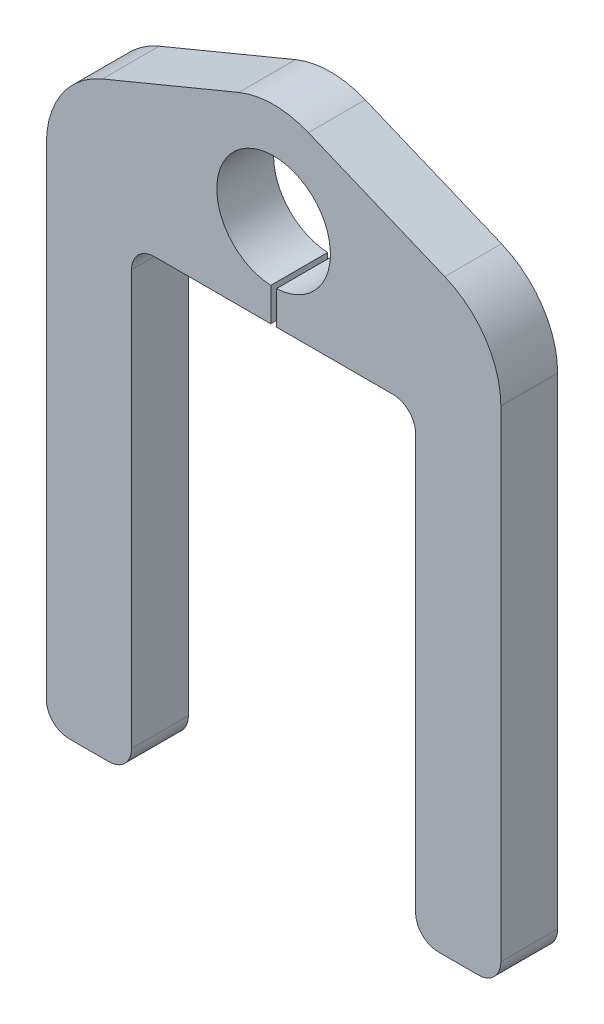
SolidWorks part; units mm, degrees
ref_plane "Front Plane" through (0, 0, 0) normal (0, 0, 1) x (1, 0, 0)
ref_plane "Top Plane" through (0, 0, 0) normal (0, 1, 0) x (1, 0, 0)
ref_plane "Right Plane" through (0, 0, 0) normal (1, 0, 0) x (0, 0, -1)
sketch "Sketch1" plane through (0, 0, 0) normal (0, 0, 1) x (1, 0, 0)
  line L2 (310.9504, 299.8517) -> (310.9504, 318.4745)
  line L3 (307.7754, 299.8517) -> (307.7754, 318.4745)
  line L4 (436.3629, 324.3937) -> (436.3629, 55.3767)
  line L5 (182.3629, 324.3937) -> (182.3629, 55.3767)
  line L6 (401.4379, 42.6767) -> (423.6629, 42.6767)
  line L7 (217.2879, 42.6767) -> (195.0629, 42.6767)
  line L8 (376.0379, 299.8517) -> (310.9504, 299.8517)
  line L9 (307.7754, 299.8517) -> (242.6879, 299.8517)
  line L10 (388.7379, 287.1517) -> (388.7379, 55.3767)
  line L11 (229.9879, 287.1517) -> (229.9879, 55.3767)
  line L12 (405.0176, 371.3208) -> (328.8176, 402.9113)
  line L13 (213.7081, 371.3208) -> (289.9081, 402.9113)
  arc A0 (182.3629, 55.3767) -> (195.0629, 42.6767) centre (195.0629, 55.3767) ccw
  arc A1 (242.6879, 299.8517) -> (229.9879, 287.1517) centre (242.6879, 287.1517) ccw
  arc A2 (388.7379, 287.1517) -> (376.0379, 299.8517) centre (376.0379, 287.1517) ccw
  arc A3 (217.2879, 42.6767) -> (229.9879, 55.3767) centre (217.2879, 55.3767) ccw
  arc A4 (388.7379, 55.3767) -> (401.4379, 42.6767) centre (401.4379, 55.3767) ccw
  arc A5 (423.6629, 42.6767) -> (436.3629, 55.3767) centre (423.6629, 55.3767) ccw
  arc A6 (436.3629, 324.3937) -> (405.0176, 371.3208) centre (385.5629, 324.3937) ccw
  arc A7 (213.7081, 371.3208) -> (182.3629, 324.3937) centre (233.1629, 324.3937) ccw
  arc A8 (328.8176, 402.9113) -> (289.9081, 402.9113) centre (309.3629, 355.9842) ccw
  arc A9 (310.9504, 318.4745) -> (307.7754, 318.4745) centre (309.3629, 350.1848) ccw
  point P3 (332.313, 372.1245)
  point P4 (286.4127, 328.245)
  point P9 (340.9264, 353.6212)
  point P10 (277.7994, 346.7483)
  dimension "D1" = 31.75
  dimension "D2" = 50.8
  dimension "D7" = 50.8
  dimension "D10" = 106.9325
  dimension "D11" = 50.8
  dimension "D19" = 12.7
  dimension "D20" = 12.7
  dimension "D21" = 12.7
  dimension "D22" = 12.7
  dimension "D3" = 257.175
  dimension "D4" = 158.75
  dimension "D5" = 47.625
  dimension "D6" = 47.625
  dimension "D8" = 22.518
  dimension "D12" = 3.175
  dimension "D13" = 3.175
  dimension "D14" = 24.542
  dimension "D15" = 24.542
  dimension "D16" = 3.175
  dimension "D17" = 79.375
  dimension "D23" = 18.6227
  dimension "D24" = 257.175
extrude "Extrude1" add sketch "Sketch1" along normal blind 31.75
